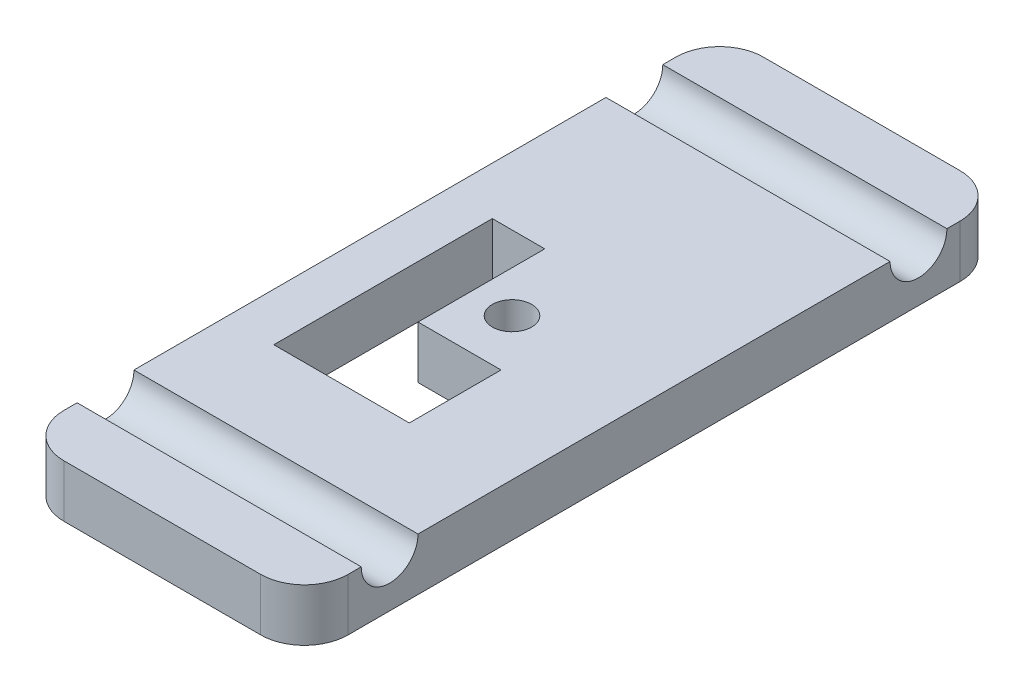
SolidWorks part; units mm, degrees
ref_plane "Front Plane" through (0, 0, 0) normal (0, 0, 1) x (1, 0, 0)
ref_plane "Top Plane" through (0, 0, 0) normal (0, 1, 0) x (1, 0, 0)
ref_plane "Right Plane" through (0, 0, 0) normal (1, 0, 0) x (0, 0, -1)
sketch "Sketch1" plane through (0, 0, 0) normal (0, 1, 0) x (1, 0, 0)
  line L1 (-32.5, 80) -> (32.5, 80)
  line L2 (-32.5, 80) -> (-32.5, -80)
  line L3 (-32.5, -80) -> (32.5, -80)
  line L4 (32.5, 80) -> (32.5, -80)
  line L9 (-21.5, 17) -> (-9.5, 17)
  line L10 (-21.5, 17) -> (-21.5, -33)
  line L13 (-9.5, 17) -> (-9.5, -12)
  line L16 (-9.5, -12) -> (9.5, -12)
  line L17 (9.5, -33) -> (9.5, -12)
  line L18 (9.5, -33) -> (-21.5, -33)
  circle A0 centre (0, 0) radius 4.5
  point P0 (0, 80)
  point P6 (-32.5, 0)
  dimension "D3" = 9
  dimension "D1" = 65
  dimension "D2" = 160
  dimension "D4" = 12
  dimension "D5" = 21
  dimension "D6" = 19
  dimension "D7" = 50
  dimension "D8" = 12
extrude "Boss-Extrude1" add sketch "Sketch1" against normal blind 12
sketch "Sketch2" plane through (-32.5, 0, 0) normal (-1, 0, 0) x (0, 0, 1)
  line L0 (-80, 0) -> (80, 0) construction
  line L1 (-80, -12) -> (-80, 0) construction
  line L2 (80, -12) -> (80, 0) construction
  circle A0 centre (-60.5, 0) radius 6.5
  circle A1 centre (60.5, 0) radius 6.5
  dimension "D1" = 13
  dimension "D2" = 19.5
  dimension "D3" = 19.5
extrude "Cut-Extrude1" cut sketch "Sketch2" against normal blind 77
fillet "Fillet1" radius 10 4 edges at (-32.5, -6, -80) (32.5, -6, -80) (32.5, -6, 80) (-32.5, -6, 80)
